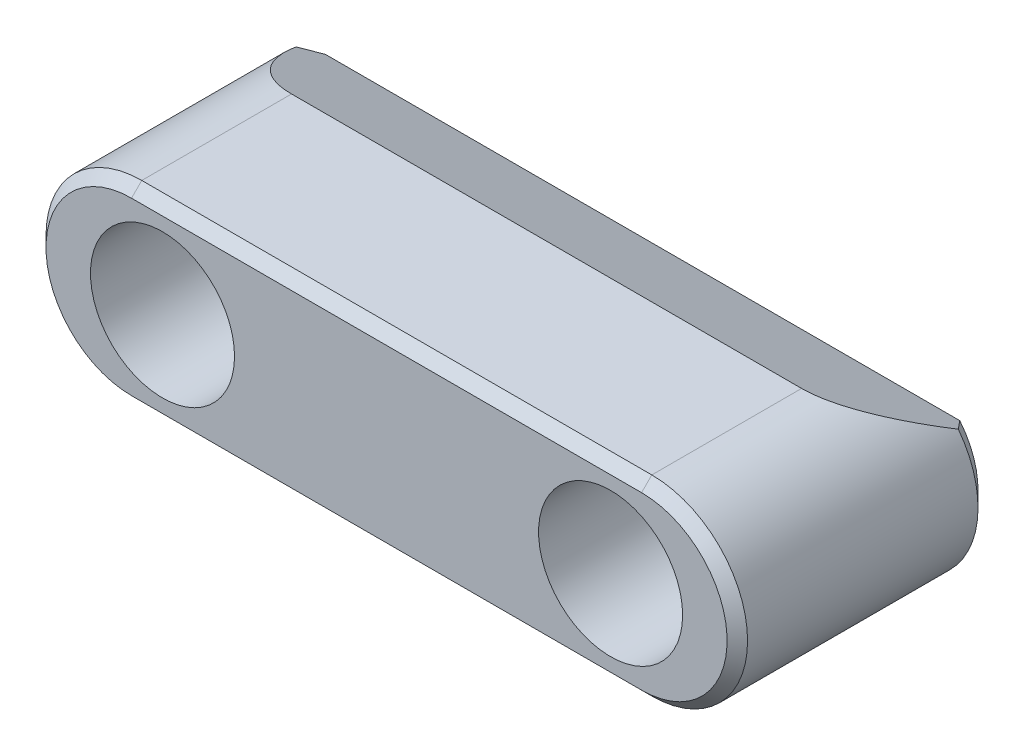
SolidWorks part; units mm, degrees
ref_plane "Front Plane" through (0, 0, 0) normal (0, 0, 1) x (1, 0, 0)
ref_plane "Top Plane" through (0, 0, 0) normal (0, 1, 0) x (1, 0, 0)
ref_plane "Right Plane" through (0, 0, 0) normal (1, 0, 0) x (0, 0, -1)
sketch "Sketch2" plane through (0, 0, 0) normal (0, 0, 1) x (1, 0, 0)
  line L0 (-12.6492, 0) -> (12.6492, 0) construction
  line L1 (-12.6492, 4.7498) -> (12.6492, 4.7498)
  line L2 (-12.6492, -4.7498) -> (12.6492, -4.7498)
  arc A0 (-12.6492, 4.7498) -> (-12.6492, -4.7498) centre (-12.6492, 0) ccw
  arc A1 (12.6492, -4.7498) -> (12.6492, 4.7498) centre (12.6492, 0) ccw
  point P2 (0, 0)
  dimension "D2" = 34.798
  dimension "D1" = 9.4996
  dimension "D3" = 25.2984
extrude "Boss-Extrude2" add sketch "Sketch2" against normal blind 12.7
hole_wizard "CBORE for #6 Socket Head Cap Screw2" positions "Sketch5" profile "Sketch6" counterbore size "#6" standard "ANSI Inch"
sketch "Sketch5" plane through (0, 0, 0) normal (0, 0, 1) x (1, 0, 0)
  line L0 (-11.1125, 0) -> (11.1125, 0) construction
  point P0 (-11.1125, 0)
  point P5 (11.1125, 0)
  dimension "D1" = 22.225
sketch "Sketch6" plane through (-11.1125, 0, 0) normal (1, 0, 0) x (0, -1, 0)
  line L0 (0, 0) -> (0, 12.7)
  line L1 (0, 12.7) -> (2.1526, 12.7)
  line L3 (2.1526, 12.7) -> (2.1526, 5.08)
  line L4 (2.1526, 5.08) -> (3.5725, 5.08)
  line L5 (3.5725, 5.08) -> (3.5725, 0)
  line L7 (3.5725, 0) -> (0, 0)
  line L11 (0, -6.35) -> (0, 107.95) construction
  dimension "Thru Hole Dia." = 4.3053
  dimension "Thru Hole Depth" = 12.7
  dimension "C'Bore Dia." = 7.145
  dimension "C'Bore Depth" = 5.08
sketch "Sketch9" plane through (0, 0, 0) normal (1, 0, 0) x (0, 0, -1)
  line L0 (12.7, 4.7498) -> (7.9375, 4.7498)
  line L1 (12.7, 4.7498) -> (0, 4.7498) construction
  line L2 (7.9375, 4.7498) -> (12.7, 2.529)
  line L3 (12.7, -4.7498) -> (12.7, 4.7498) construction
  line L4 (12.7, 2.529) -> (12.7, 4.7498)
  dimension "D1" = 25
  dimension "D2" = 4.7625
extrude "Cut-Extrude1" cut sketch "Sketch9" against normal through all both and the other way through all
chamfer "Chamfer1" distance 0.508 angle 45 4 edges at (0, -4.7498, 0) (17.399, 0, 0) (-17.399, 0, 0) (0, 4.7498, 0)
chamfer "Chamfer2" distance 0.762 angle 45 3 edges at (-16.8069, -2.2966, -12.7) (16.8069, -2.2966, -12.7) (0, -4.7498, -12.7)
